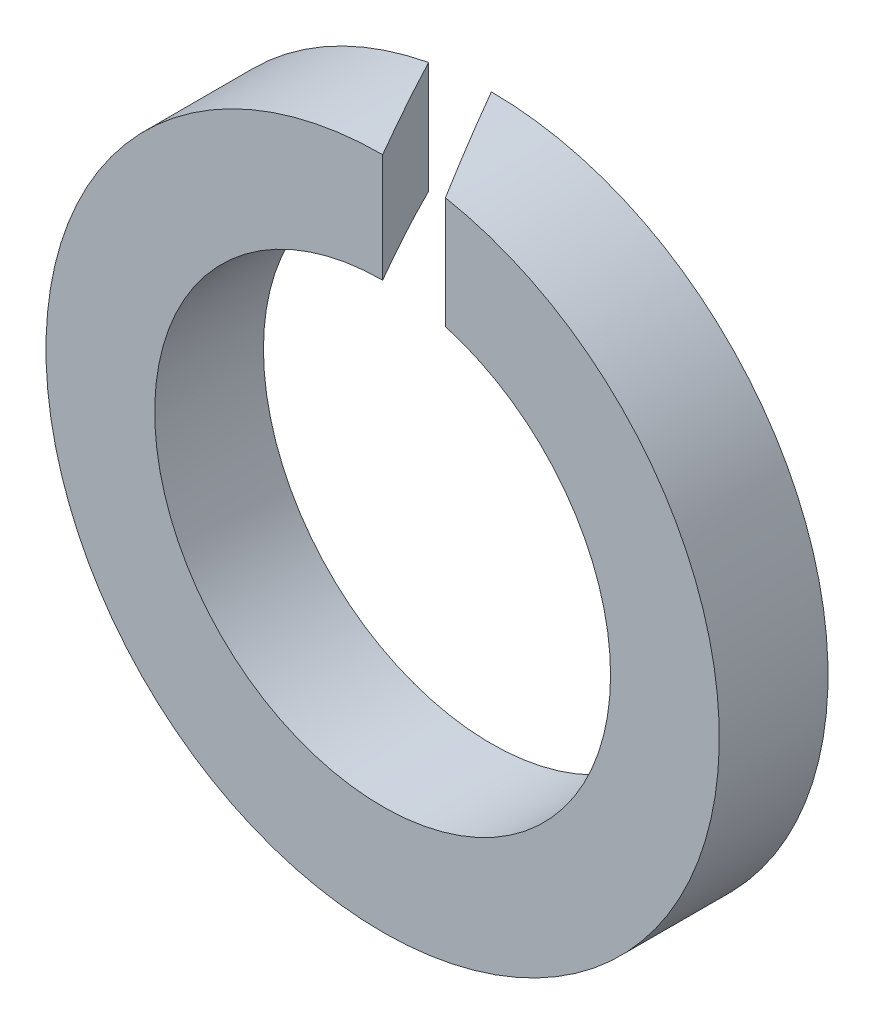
SolidWorks part; units mm, degrees
ref_plane "Front" through (0, 0, 0) normal (0, 0, 1) x (1, 0, 0)
ref_plane "Top" through (0, 0, 0) normal (0, 1, 0) x (1, 0, 0)
ref_plane "Right" through (0, 0, 0) normal (1, 0, 0) x (0, 0, -1)
sketch "Sketch1" plane through (0, 0, 0) normal (0, 0, 1) x (1, 0, 0)
  circle A0 centre (0, 0) radius 5.45
  circle A1 centre (0, 0) radius 8.05
  dimension "d" = 10.9
  dimension "b" = 2.6
extrude "Base-Extrude" add sketch "Sketch1" against normal blind 2.6
sketch "Sketch2" plane through (0, 0, 0) normal (0, 1, 0) x (1, 0, 0)
  line L0 (0, 2.6) -> (1.5011, 0)
  line L1 (1.5011, 0) -> (0, 0)
  line L3 (0, 0) -> (-1.5011, 2.6)
  line L5 (-1.5011, 2.6) -> (0, 2.6)
  line L7 (8.05, 2.6) -> (-8.05, 2.6) construction
  dimension "m" = 1.3
extrude "Cut-Extrude1" cut sketch "Sketch2" along normal through all
